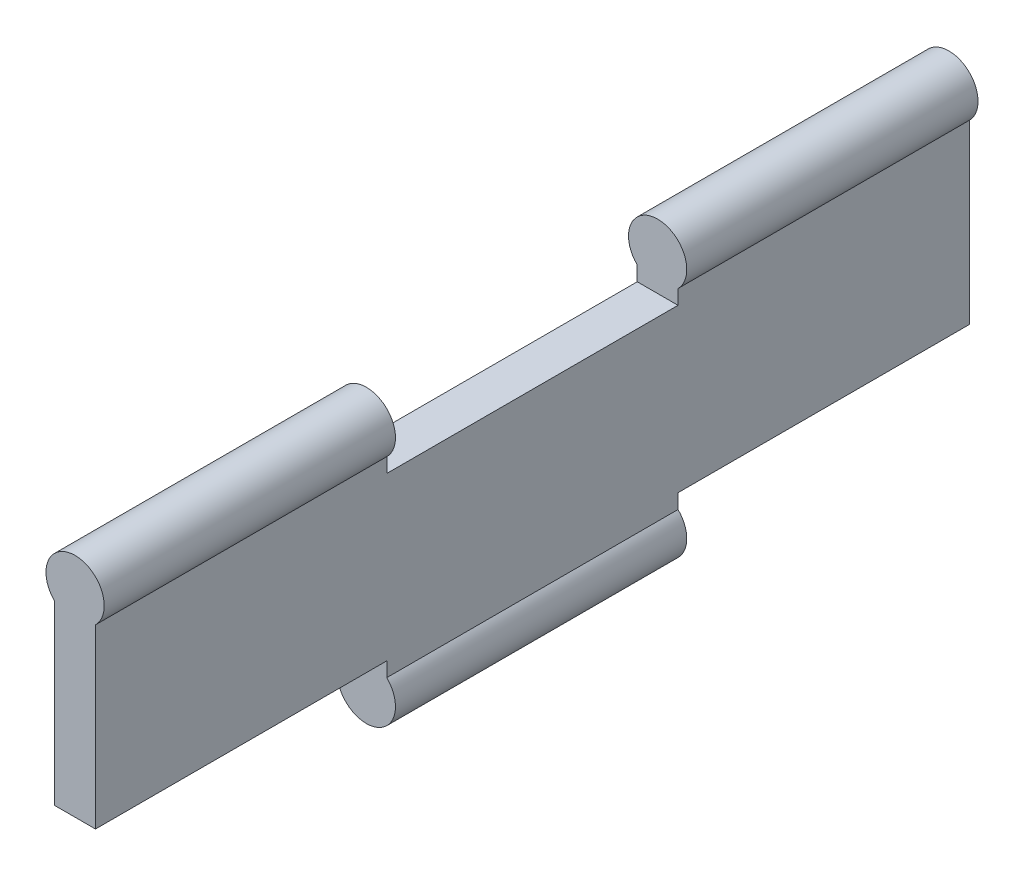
SolidWorks part; units mm, degrees
ref_plane "Front" through (0, 0, 0) normal (0, 0, 1) x (1, 0, 0)
ref_plane "Top" through (0, 0, 0) normal (0, 1, 0) x (1, 0, 0)
ref_plane "Right" through (0, 0, 0) normal (1, 0, 0) x (0, 0, -1)
sketch "Szkic1" plane through (0, 0, 0) normal (0, 0, 1) x (1, 0, 0)
  line L2 (-7, 72.8586) -> (-7, 7.1414)
  line L4 (7, 72.8586) -> (7, 7.1414)
  line L5 (-10, 140) -> (10, -0.1673) construction
  line L6 (-10, -0.1673) -> (10, 140) construction
  arc A0 (-7, 7.1414) -> (7, 7.1414) centre (0, 0) ccw
  arc A1 (7, 72.8586) -> (-7, 72.8586) centre (0, 80) ccw
  point P3 (0, 69.9163)
  dimension "D1" = 20
  dimension "D2" = 80
  dimension "D3" = 14
  dimension "D4" = 7
extrude "Dodanie-wyciągnięcie1" add sketch "Szkic1" along normal blind 300
sketch "Szkic2" plane through (7, 0, 0) normal (1, 0, 0) x (0, 0, -1)
  line L0 (0, 90) -> (-300, 90) construction
  line L1 (-200, 112.1414) -> (-100, 112.1414)
  line L2 (-200, 112.1414) -> (-200, 67.8586)
  line L3 (-200, 67.8586) -> (-100, 67.8586)
  line L4 (-100, 112.1414) -> (-100, 67.8586)
  line L5 (-200, 112.1414) -> (-100, 67.8586) construction
  line L6 (-200, 67.8586) -> (-100, 112.1414) construction
  line L7 (-300, 72.8586) -> (0, 72.8586) construction
  line L8 (-300, -10) -> (0, -10) construction
  line L9 (-338.8427, -32.1414) -> (-200, -32.1414)
  line L10 (-338.8427, -32.1414) -> (-338.8427, 12.1414)
  line L11 (-338.8427, 12.1414) -> (-200, 12.1414)
  line L12 (-200, -32.1414) -> (-200, 12.1414)
  line L13 (-338.8427, -32.1414) -> (-200, 12.1414) construction
  line L14 (-338.8427, 12.1414) -> (-200, -32.1414) construction
  line L15 (-300, 7.1414) -> (0, 7.1414) construction
  line L16 (11.2524, -32.1414) -> (-100, -32.1414)
  line L17 (11.2524, -32.1414) -> (11.2524, 12.1414)
  line L18 (11.2524, 12.1414) -> (-100, 12.1414)
  line L19 (-100, -32.1414) -> (-100, 12.1414)
  line L20 (11.2524, -32.1414) -> (-100, 12.1414) construction
  line L21 (11.2524, 12.1414) -> (-100, -32.1414) construction
  point P0 (-150, 90)
  point P9 (-269.4214, -10)
  point P16 (-44.3738, -10)
  dimension "D1" = 100
  dimension "D2" = 5
  dimension "D3" = 5
extrude "Wytnij-wyciągnięcie1" cut sketch "Szkic2" against normal blind 103 and the other way blind 75
